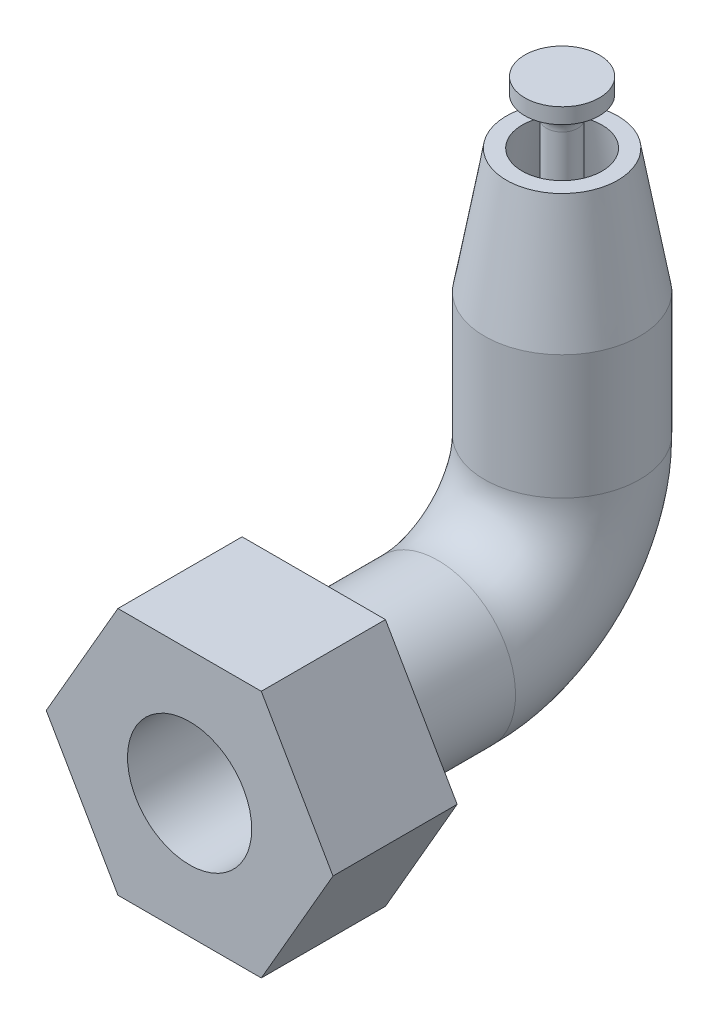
SolidWorks part; units mm, degrees
ref_plane "Front Plane" through (0, 0, 0) normal (0, 0, 1) x (1, 0, 0)
ref_plane "Top Plane" through (0, 0, 0) normal (0, 1, 0) x (1, 0, 0)
ref_plane "Right Plane" through (0, 0, 0) normal (1, 0, 0) x (0, 0, -1)
sketch "Sketch4" plane through (0, 0, 0) normal (0, 0, 1) x (1, 0, 0)
  line L0 (-799.4747, 0) -> (39174.2623, 0) construction
  line L8 (29.3294, 0) -> (14.6647, 25.4)
  line L9 (14.6647, 25.4) -> (-14.6647, 25.4)
  line L10 (-14.6647, 25.4) -> (-29.3294, 0)
  line L11 (-29.3294, 0) -> (-14.6647, -25.4)
  line L12 (-14.6647, -25.4) -> (14.6647, -25.4)
  line L13 (14.6647, -25.4) -> (29.3294, 0)
  circle A0 centre (0, 0) radius 25.4 construction
  circle A1 centre (0, 0) radius 12.7
  dimension "D2" = 25.4
  dimension "D1" = 50.8
extrude "Boss-Extrude1" add sketch "Sketch4" along normal blind 25.4
sketch "Sketch101" plane through (0, 0, 0) normal (1, 0, 0) x (0, 0, -1)
  line L0 (0, 0) -> (25.4, 0)
  line L1 (50.8, 25.4) -> (50.8, 50.8)
  line L2 (0, -25.4) -> (0, 0) construction
  arc A0 (25.4, 0) -> (50.8, 25.4) centre (25.4, 25.4) ccw
  dimension "D1" = 25.4
  dimension "D2" = 25.4
sketch "Sketch102" plane through (0, 0, 0) normal (0, 0, -1) x (-1, 0, 0)
  circle A0 centre (0, 0) radius 12.7
  circle A1 centre (0, 0) radius 15.875
  dimension "D1" = 31.75
  dimension "D2" = 25.4
sweep "Sweep3" add profiles "Sketch102" path "Sketch101"
sketch "Sketch7" plane through (0, 0, 0) normal (0, 0, -1) x (-1, 0, 0)
  circle A0 centre (0, 0) radius 12.7
  circle A1 centre (0, 0) radius 15.875
  dimension "D1" = 31.75
  dimension "D2" = 25.4
sketch "Sketch79" plane through (0, 0, 0) normal (1, 0, 0) x (0, 0, -1)
  line L1 (0, -992.0082) -> (0, 49007.9918) construction
  line L2 (25.4, -999.5102) -> (25.4, 49000.4898) construction
  line L5 (-974.6, 0) -> (49025.4, 0) construction
  arc A3 (25.4, 0) -> (57.2079, 25.4) centre (31.1625, 25.4) ccw
  dimension "D1" = 25.4
sketch "Sketch104" plane through (0, 0, 0) normal (1, 0, 0) x (0, 0, -1)
  line L0 (34.925, 50.8) -> (66.675, 50.8) construction
  line L1 (47.625, 81.28) -> (47.625, 53.975)
  line L2 (66.675, 25.4) -> (66.675, 50.8) construction
  line L3 (66.675, 50.8) -> (34.925, 50.8) construction
  line L4 (50.8, -949.2) -> (50.8, 49050.8) construction
  line L5 (34.925, 50.8) -> (39.4037, 76.2)
  line L6 (39.4037, 76.2) -> (42.6277, 76.2)
  line L7 (42.6277, 76.2) -> (38.7088, 53.975)
  line L8 (38.7088, 53.975) -> (47.625, 53.975)
  line L9 (50.8, 50.8) -> (34.925, 50.8)
  line L10 (50.8, 88.9) -> (43.18, 88.9)
  line L11 (43.18, 88.9) -> (43.18, 85.725)
  line L12 (34.925, -949.2) -> (34.925, 49050.8) construction
  line L13 (50.8, 88.9) -> (50.8, 50.8)
  arc A0 (43.18, 85.725) -> (47.625, 81.28) centre (43.18, 81.28) cw
  point P10 (50.8, 50.8)
  dimension "D4" = 4.445
  dimension "D1" = 25.4
  dimension "D2" = 3.175
  dimension "D3" = 3.175
  dimension "D5" = 7.62
  dimension "D6" = 3.175
  dimension "D7" = 10
  dimension "D9" = 38.1
revolve "Revolve2" add sketch "Sketch104" angle 360 about L4
sketch "Sketch105" plane through (0, 53.975, 0) normal (0, 1, 0) x (1, 0, 0)
  line L0 (0, -949.2) -> (0, 49050.8) construction
  line L1 (-11.3963, 50.8) -> (11.3963, 50.8) construction
  circle A0 centre (0, 50.8) radius 11.3963 construction
  circle A1 centre (-8.89, 50.8) radius 2.54
  circle A2 centre (-4.445, 58.499) radius 2.54
  circle A3 centre (4.445, 58.499) radius 2.54
  circle A4 centre (8.89, 50.8) radius 2.54
  circle A5 centre (4.445, 43.101) radius 2.54
  circle A6 centre (-4.445, 43.101) radius 2.54
  point P22 (0, 50.8)
  dimension "D1" = 5.08
  dimension "D2" = 8.89
  dimension "D3" = 6
extrude "Cut-Extrude1" cut sketch "Sketch105" against normal blind 31.75
